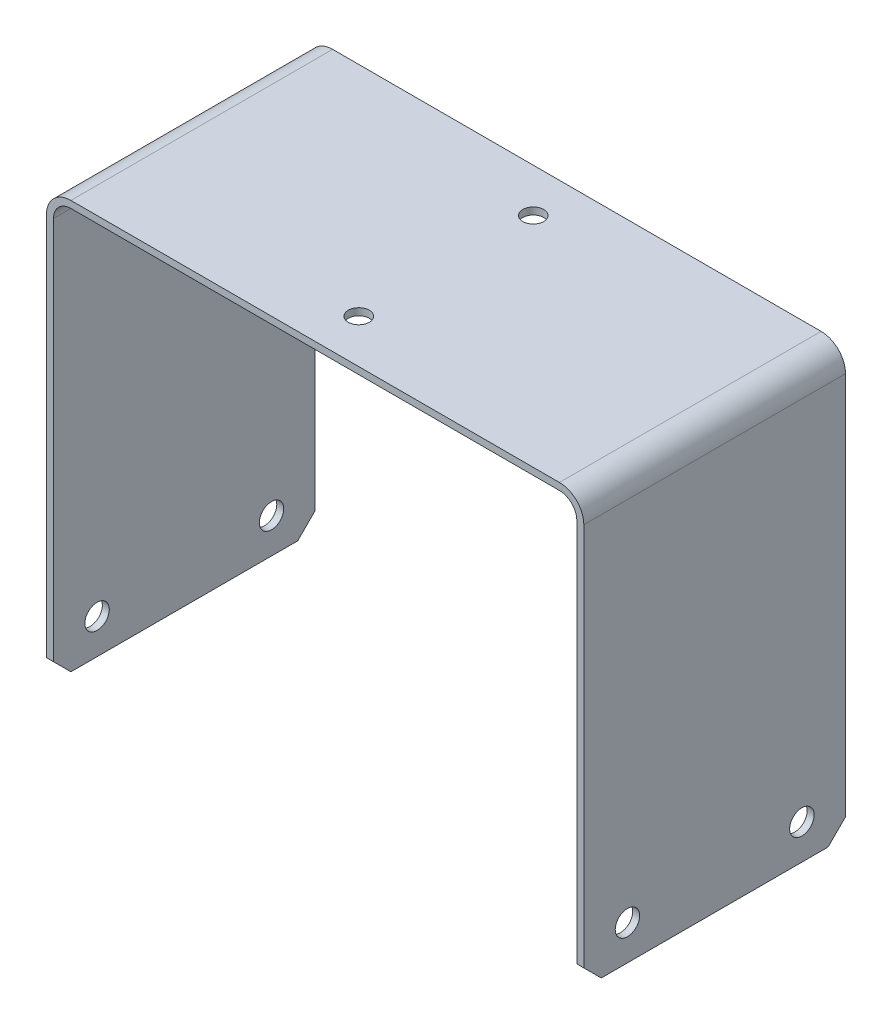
SolidWorks part; units mm, degrees
ref_plane "Plan de face" through (0, 0, 0) normal (0, 0, 1) x (1, 0, 0)
ref_plane "Plan de dessus" through (0, 0, 0) normal (0, 1, 0) x (1, 0, 0)
ref_plane "Plan de droite" through (0, 0, 0) normal (1, 0, 0) x (0, 0, -1)
sketch "Esquisse1" plane through (0, 0, 0) normal (0, 0, 1) x (1, 0, 0)
  line L0 (0, 0) -> (0, 46.398) construction
  line L1 (-75, -20) -> (-75, 95)
  line L2 (-70, 100) -> (70, 100)
  line L3 (75, 95) -> (75, -20)
  arc A0 (-75, 95) -> (-70, 100) centre (-70, 95) cw
  arc A1 (75, 95) -> (70, 100) centre (70, 95) ccw
  dimension "D1" = 5
  dimension "D2" = 150
  dimension "D3" = 75
  dimension "D4" = 100
  dimension "D5" = 20
extrude "Extru.-Mince1" add sketch "Esquisse1" along normal mid plane 75 thin
sketch "Esquisse2" plane through (0, 102, 0) normal (0, 1, 0) x (-1, 0, 0)
  circle A1 centre (0, 25) radius 3
  circle A2 centre (0, -25) radius 3
  dimension "D1" = 6
  dimension "D3" = 50
  dimension "D4" = 25
extrude "Enlèv. mat.-Extru.1" cut sketch "Esquisse2" against normal blind 75
chamfer "Chanfrein1" distance 5 angle 45 4 edges at (76, -20, -37.5) (76, -20, 37.5) (-76, -20, -37.5) (-76, -20, 37.5)
sketch "Esquisse3" plane through (-77, 0, 0) normal (-1, 0, 0) x (0, 0, 1)
  line L3 (32.5, -20) -> (-32.5, -20) construction
  circle A0 centre (25, -10) radius 3.5
  circle A1 centre (-25, -10) radius 3.5
  dimension "D3" = 7
  dimension "D1" = 50
  dimension "D2" = 25
  dimension "D4" = 10
extrude "Enlèv. mat.-Extru.2" cut sketch "Esquisse3" against normal through all
